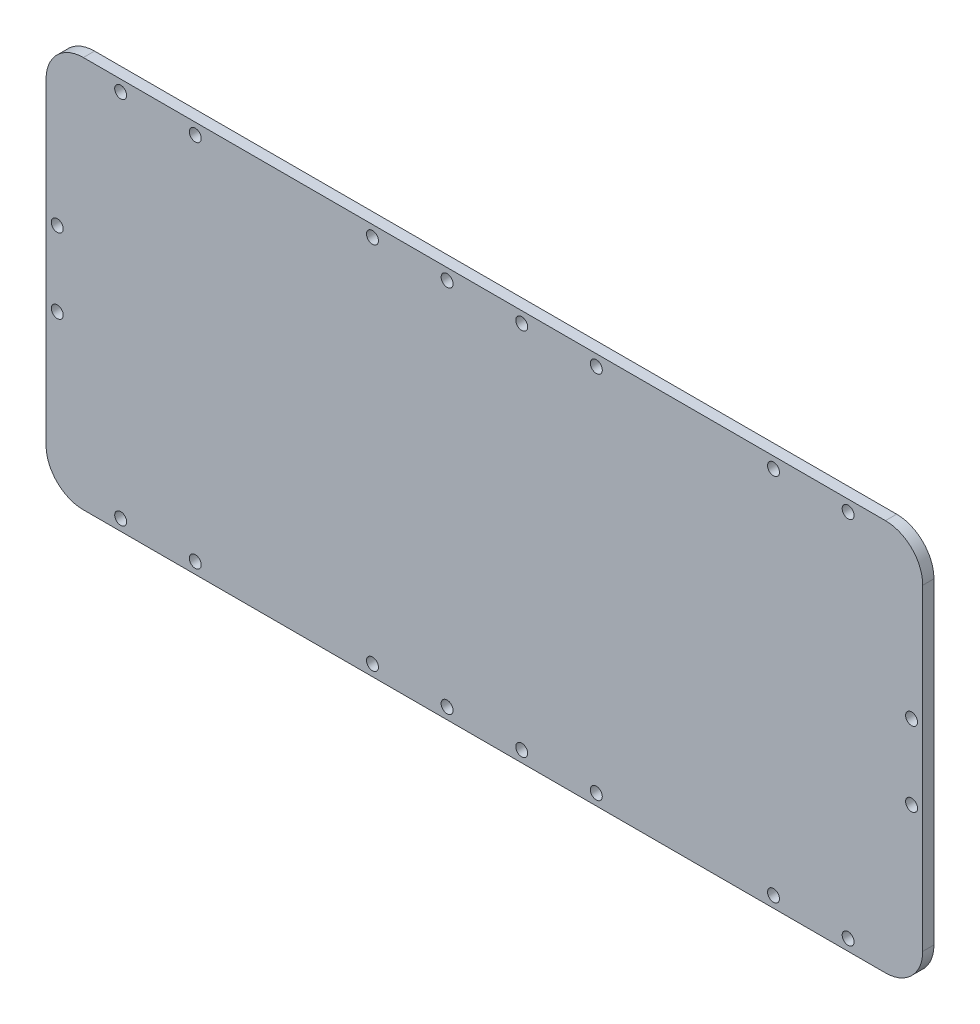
SolidWorks part; units mm, degrees
ref_plane "前视基准面" through (0, 0, 0) normal (0, 0, 1) x (1, 0, 0)
ref_plane "上视基准面" through (0, 0, 0) normal (0, 1, 0) x (1, 0, 0)
ref_plane "右视基准面" through (0, 0, 0) normal (1, 0, 0) x (0, 0, -1)
sketch "草图1" plane through (0, 0, 0) normal (0, 0, 1) x (1, 0, 0)
  line L1 (0, 0) -> (269, 0)
  line L2 (0, 0) -> (0, 105)
  line L3 (0, 105) -> (269, 105)
  line L4 (269, 0) -> (269, 105)
  dimension "D1" = 105
  dimension "D2" = 269
extrude "凸台-拉伸1" add sketch "草图1" along normal blind 3
sketch "草图2" plane through (0, 0, 3) normal (0, 0, 1) x (1, 0, 0)
  line L0 (0, 105) -> (0, 0) construction
  line L1 (0, 0) -> (269, 0) construction
  line L2 (134.5, 0) -> (134.5, 72.3529) construction
  line L3 (0, 52.5) -> (269, 52.5) construction
  line L4 (269, 0) -> (269, 105) construction
  line L5 (134.5, 105) -> (134.5, 32.6471) construction
  circle A0 centre (37, 3) radius 1.6
  circle A1 centre (57, 3) radius 1.6
  circle A2 centre (104.5, 3) radius 1.6
  circle A3 centre (124.5, 3) radius 1.6
  circle A4 centre (144.5, 3) radius 1.6
  circle A5 centre (164.5, 3) radius 1.6
  circle A6 centre (212, 3) radius 1.6
  circle A7 centre (232, 3) radius 1.6
  circle A8 centre (232, 102) radius 1.6
  circle A9 centre (212, 102) radius 1.6
  circle A10 centre (164.5, 102) radius 1.6
  circle A11 centre (144.5, 102) radius 1.6
  circle A12 centre (124.5, 102) radius 1.6
  circle A13 centre (104.5, 102) radius 1.6
  circle A14 centre (57, 102) radius 1.6
  circle A15 centre (37, 102) radius 1.6
  dimension "D1" = 37
  dimension "D2" = 104.5
  dimension "D3" = 20
  dimension "D4" = 20
  dimension "D5" = 3
  dimension "D6" = 3
  dimension "D7" = 3
  dimension "D8" = 3
  dimension "D9" = 3.2
  dimension "D10" = 3.2
  dimension "D11" = 3.2
  dimension "D12" = 3.2
extrude "切除-拉伸1" cut sketch "草图2" against normal blind 3
sketch "草图4" plane through (0, 0, 3) normal (0, 0, 1) x (1, 0, 0)
  line L0 (0, 0) -> (269, 0) construction
  line L1 (0, 105) -> (17, 105)
  line L2 (0, 105) -> (0, 0)
  line L3 (0, 0) -> (17, 0)
  line L4 (17, 105) -> (17, 0)
  line L6 (269, 105) -> (252, 105)
  line L7 (269, 105) -> (269, 0)
  line L8 (269, 0) -> (252, 0)
  line L9 (252, 105) -> (252, 0)
  dimension "D1" = 235
  dimension "D2" = 17
extrude "切除-拉伸2" cut sketch "草图4" against normal blind 5
sketch "草图5" plane through (0, 0, 3) normal (0, 0, 1) x (1, 0, 0)
  line L0 (17, 0) -> (17, 105) construction
  line L1 (17, 52.5) -> (81.8903, 52.5) construction
  line L2 (134.5, 105) -> (134.5, 85) construction
  line L3 (252, 105) -> (17, 105) construction
  circle A1 centre (20, 102.5) radius 1.6
  circle A2 centre (20, 82.5) radius 1.6
  circle A3 centre (20, 22.5) radius 1.6
  circle A4 centre (20, 2.5) radius 1.6
  circle A5 centre (249, 2.5) radius 1.6
  circle A6 centre (249, 22.5) radius 1.6
  circle A7 centre (249, 82.5) radius 1.6
  circle A8 centre (249, 102.5) radius 1.6
  dimension "D1" = 3.2
  dimension "D2" = 3
  dimension "D3" = 3
  dimension "D4" = 20
  dimension "D5" = 30
sketch "草图6" plane through (0, 0, 3) normal (0, 0, 1) x (1, 0, 0)
  line L0 (17, 0) -> (17, 105) construction
  line L1 (17, 52.5) -> (81.8903, 52.5) construction
  line L2 (134.5, 105) -> (134.5, 57.9424) construction
  circle A0 centre (20, 62.5) radius 1.6
  circle A1 centre (20, 42.5) radius 1.6
  circle A2 centre (249, 42.5) radius 1.6
  circle A3 centre (249, 62.5) radius 1.6
  dimension "D1" = 20
  dimension "D2" = 3
  dimension "D3" = 3.2
  dimension "D4" = 3.2
  dimension "D5" = 10
extrude "切除-拉伸3" cut sketch "草图6" against normal blind 10
fillet "圆角1" radius 10 4 edges at (17, 0, 1.5) (252, 0, 1.5) (252, 105, 1.5) (17, 105, 1.5)
